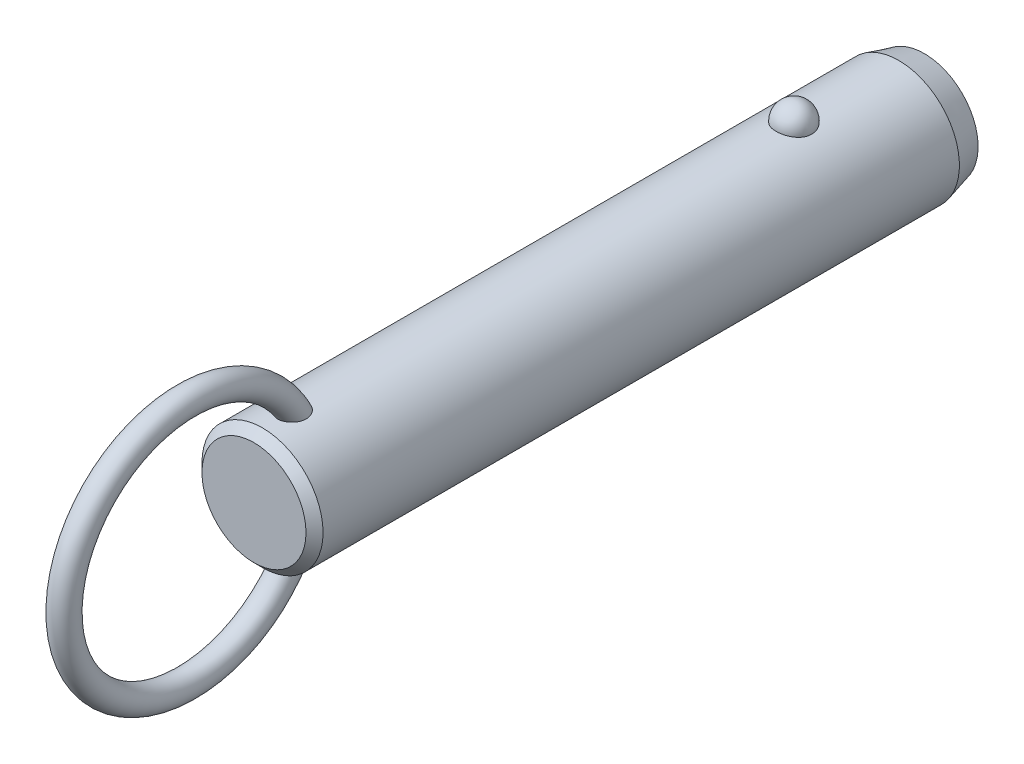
SolidWorks part; units mm, degrees
ref_plane "Front Plane" through (0, 0, 0) normal (0, 0, 1) x (1, 0, 0)
ref_plane "Top Plane" through (0, 0, 0) normal (0, 1, 0) x (1, 0, 0)
ref_plane "Right Plane" through (0, 0, 0) normal (1, 0, 0) x (0, 0, -1)
sketch "Sketch2" plane through (0, 0, 0) normal (0, 0, 1) x (1, 0, 0)
  circle A0 centre (0, 0) radius 7.1
  point P3 (0, 7.1)
  dimension "D1" = 14.2
extrude "Boss-Extrude1" add sketch "Sketch2" along normal blind 53.3
sketch "Sketch3" plane through (0, 0, 0) normal (0, 0, -1) x (-1, 0, 0)
  circle A0 centre (0, 0) radius 7.1
  dimension "D1" = 14.2
extrude "Boss-Extrude2" add sketch "Sketch3" along normal blind 17.4
chamfer "Chamfer1" distance 3 angle 15 1 edges at (-7.1, 0, -17.4)
sketch "Sketch12" plane through (0, 0, 0) normal (1, 0, 0) x (0, 0, -1)
  line L0 (-53.3, 7.1) -> (-53.3, -7.1) construction
  point P0 (-53.3, 0)
sketch "Sketch13" plane through (0, 0, 0) normal (1, 0, 0) x (0, 0, -1)
  circle A0 centre (-69.15, 0) radius 15.85
  point P2 (-53.3, 0)
  dimension "D1" = 31.7
sketch "Sketch14" plane through (0, 0, 0) normal (0, 1, 0) x (1, 0, 0)
  circle A0 centre (0, -54.8) radius 1.5
  point P2 (0, -53.3)
  dimension "D1" = 3
sweep "Sweep1" add profiles "Sketch14" path "Sketch13"
sketch "Sketch15" plane through (0, 0, 53.3) normal (0, 0, 1) x (1, 0, 0)
  circle A0 centre (0, 0) radius 7.1
  dimension "D1" = 14.2
extrude "Boss-Extrude3" add sketch "Sketch15" along normal blind 7.92
chamfer "Chamfer2" distance 1 angle 45 1 edges at (7.1, 0, 61.22)
sketch "Sketch18" plane through (0, 0, 0) normal (1, 0, 0) x (0, 0, -1)
  line L0 (14.4, 7.1) -> (-54.9792, 7.1) construction
  line L1 (2.1, 9.2) -> (2.1, 5)
  line L2 (-54.9792, -7.1) -> (14.4, -7.1) construction
  arc A0 (2.1, 9.2) -> (2.1, 5) centre (2.1, 7.1) ccw
  point P4 (0, 7.1)
  dimension "D1" = 16.3
revolve "Revolve1" add sketch "Sketch18" angle 360 about L1
